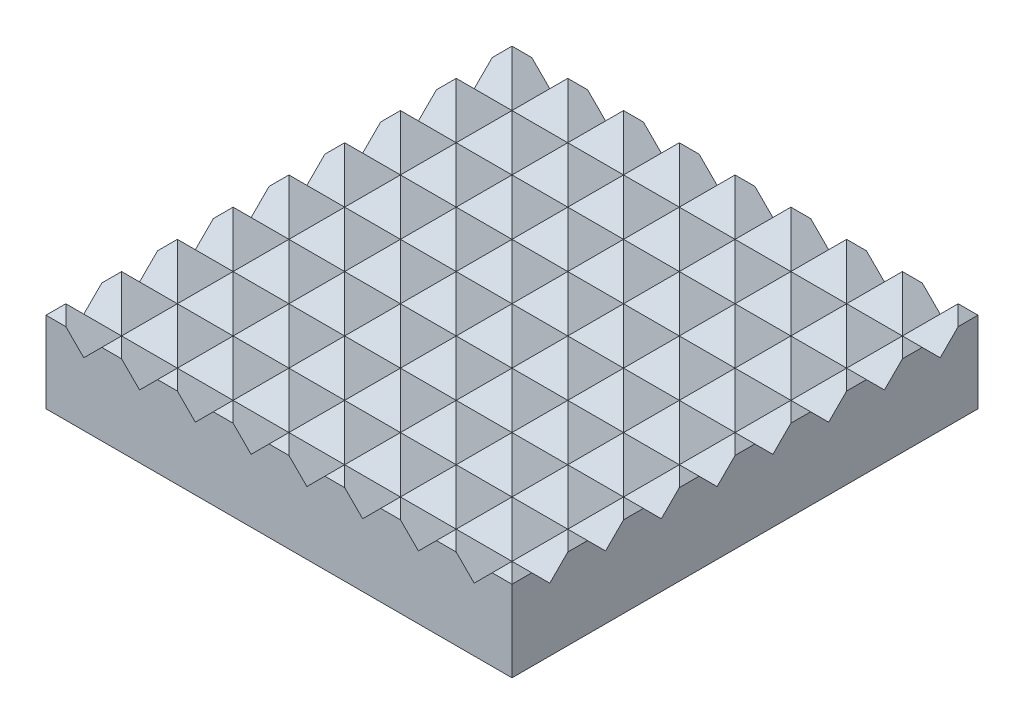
SolidWorks part; units mm, degrees
ref_plane "Front Plane" through (0, 0, 0) normal (0, 0, 1) x (1, 0, 0)
ref_plane "Top Plane" through (0, 0, 0) normal (0, 1, 0) x (1, 0, 0)
ref_plane "Right Plane" through (0, 0, 0) normal (1, 0, 0) x (0, 0, -1)
sketch "Sketch1" plane through (0, 0, 0) normal (0, 1, 0) x (1, 0, 0)
  line L0 (-9.525, -9.525) -> (-9.525, 9.525)
  line L1 (0, 0) -> (0, 50000) construction
  line L2 (0, 0) -> (50000, 0) construction
  line L3 (-9.525, 9.525) -> (9.525, 9.525)
  line L4 (9.525, -9.525) -> (9.525, 9.525)
  line L5 (-9.525, -9.525) -> (9.525, -9.525)
  point P10 (0, 9.525)
  point P11 (9.525, 0)
  point P12 (-9.525, 0)
  dimension "D1" = 19.05
  dimension "D2" = 19.05
extrude "Extrude1" add sketch "Sketch1" along normal mid plane 3.97
sketch "Sketch2" plane through (0, 0, 9.525) normal (0, 0, 1) x (1, 0, 0)
  line L0 (-10.26, 1.985) -> (-11.4, 1.985)
  line L1 (-11.4, 1.985) -> (-10.26, 0.845)
  line L2 (-9.525, -1.985) -> (9.525, -1.985) construction
  line L3 (-10.26, 0.845) -> (-9.12, 1.985)
  line L5 (-9.12, 1.985) -> (-10.26, 1.985)
  line L10 (-9.525, 1.985) -> (-9.525, -1.985) construction
  dimension "D1" = 2.28
  dimension "D2" = 1.875
  dimension "D3" = 3.97
extrude "Extrude3" cut sketch "Sketch2" against normal through all
pattern_linear "LPattern2" count 10 spacing 2.28 along (0.7071, -0.7071, 0) of "Extrude3"
sketch "Sketch3" plane through (9.525, 0, 0) normal (1, 0, 0) x (0, 0, -1)
  line L0 (-10.26, 1.985) -> (-9.12, 1.985)
  line L2 (-9.12, 1.985) -> (-10.26, 0.845)
  line L3 (-10.26, 0.845) -> (-11.4, 1.985)
  line L4 (-11.4, 1.985) -> (-10.26, 1.985)
  line L5 (-9.525, 1.58) -> (-9.525, -1.985) construction
  line L6 (9.525, -2.98) -> (-9.525, -2.98) construction
  line L8 (-9.525, -1.985) -> (9.525, -1.985) construction
  dimension "D1" = 2.28
  dimension "D2" = 1.875
  dimension "D3" = 3.97
extrude "Extrude4" cut sketch "Sketch3" against normal through all
pattern_linear "LPattern3" count 10 spacing 2.28 along (0, -0.7071, -0.7071) of "Extrude4"
chamfer "Chamfer1" distance 0.25 angle 45 4 edges at (-9.525, -1.985, 0) (0, -1.985, -9.525) (9.525, -1.985, 0) (0, -1.985, 9.525)
equation "\"D2@Sketch1\" = \"D1@Sketch1\""
equation "\"D1@Sketch3\" = \"D1@Sketch2\""
equation "\"D2@Sketch3\" = \"D2@Sketch2\""
equation "\"D3@Sketch3\" = \"D1@Extrude1\""
equation "\"D3@Sketch2\" = \"D1@Extrude1\""
